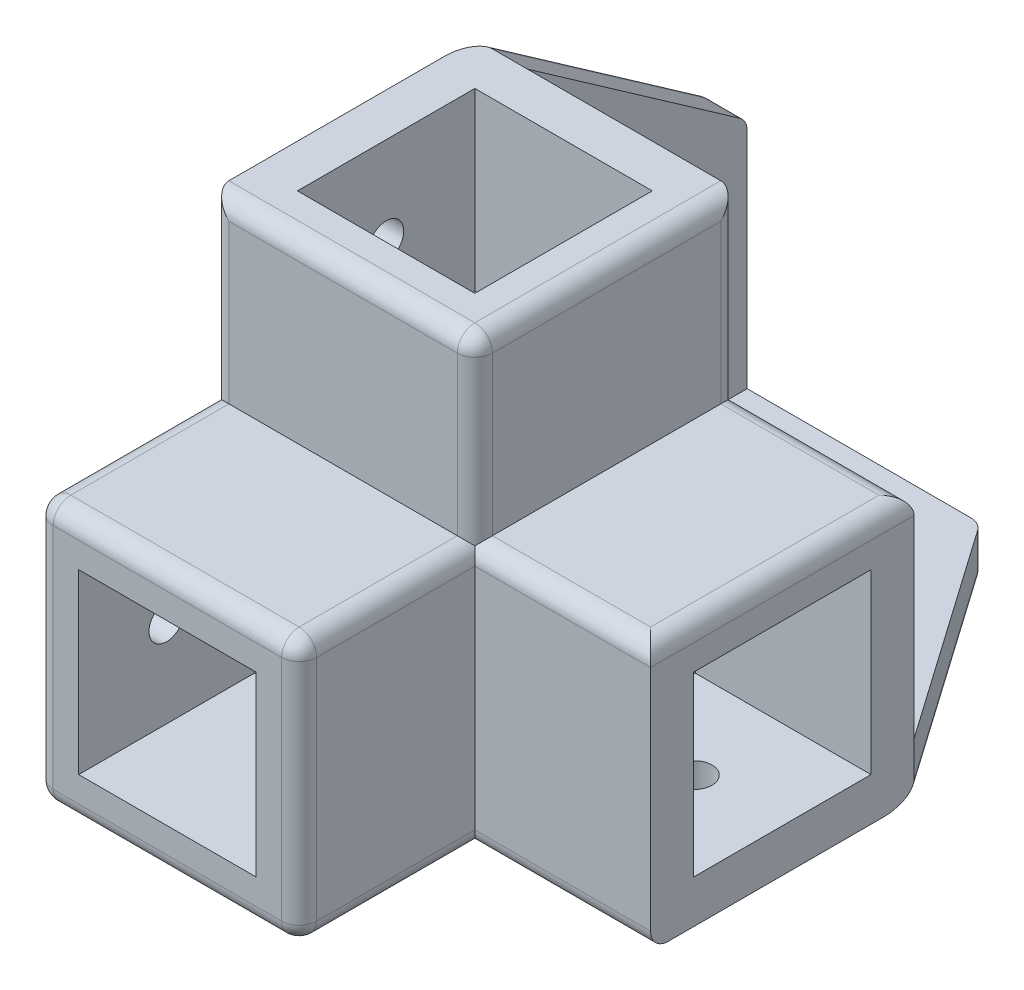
SolidWorks part; units mm, degrees
ref_plane "Alzado" through (0, 0, 0) normal (0, 0, 1) x (1, 0, 0)
ref_plane "Planta" through (0, 0, 0) normal (0, 1, 0) x (1, 0, 0)
ref_plane "Vista lateral" through (0, 0, 0) normal (1, 0, 0) x (0, 0, -1)
sketch "Sketch1" plane through (0, 0, 0) normal (0, 0, 1) x (1, 0, 0)
  line L1 (0, 50) -> (30, 50)
  line L2 (0, 50) -> (0, 0)
  line L3 (0, 0) -> (50, 0)
  line L4 (30, 50) -> (30, 30)
  line L5 (50, 0) -> (0, 0)
  line L6 (50, 0) -> (50, 30)
  line L7 (50, 30) -> (30, 30)
  line L8 (0, 0) -> (0, 50)
  dimension "D1" = 30
  dimension "D2" = 30
  dimension "D3" = 20
  dimension "D4" = 20
extrude "Boss-Extrude1" add sketch "Sketch1" along normal blind 30 contours L2 L1 L4 L7 L6 L5
sketch "Sketch2" plane through (0, 0, 30) normal (0, 0, 1) x (1, 0, 0)
  line L1 (30, 30) -> (0, 30)
  line L2 (30, 30) -> (30, 0)
  line L3 (30, 0) -> (0, 0)
  line L4 (0, 30) -> (0, 0)
extrude "Boss-Extrude2" add sketch "Sketch2" along normal blind 20
sketch "Sketch3" plane through (0, 0, 50) normal (0, 0, 1) x (1, 0, 0)
  line L0 (0, 0) -> (30, 0) construction
  line L1 (4.9, 25.1) -> (25.1, 25.1)
  line L2 (4.9, 25.1) -> (4.9, 4.9)
  line L3 (4.9, 4.9) -> (25.1, 4.9)
  line L4 (25.1, 25.1) -> (25.1, 4.9)
  line L5 (4.9, 25.1) -> (25.1, 4.9) construction
  line L6 (4.9, 4.9) -> (25.1, 25.1) construction
  line L7 (0, 30) -> (0, 0) construction
  point P0 (15, 15)
  point P8 (15, 0)
  point P11 (0, 15)
  dimension "D1" = 20.2
  dimension "D2" = 20.2
extrude "Cut-Extrude1" cut sketch "Sketch3" against normal blind 20
sketch "Sketch4" plane through (50, 0, 0) normal (1, 0, 0) x (0, 0, -1)
  line L0 (0, 0) -> (0, 30) construction
  line L1 (-25.1, 25.1) -> (-4.9, 25.1)
  line L2 (-25.1, 25.1) -> (-25.1, 4.9)
  line L3 (-25.1, 4.9) -> (-4.9, 4.9)
  line L4 (-4.9, 25.1) -> (-4.9, 4.9)
  line L5 (-25.1, 25.1) -> (-4.9, 4.9) construction
  line L6 (-25.1, 4.9) -> (-4.9, 25.1) construction
  line L7 (-30, 0) -> (0, 0) construction
  point P0 (-15, 15)
  point P7 (0, 15)
  point P10 (-15, 0)
extrude "Cut-Extrude2" cut sketch "Sketch4" against normal blind 20
sketch "Sketch5" plane through (0, 50, 0) normal (0, 1, 0) x (1, 0, 0)
  line L0 (0, -30) -> (0, 0) construction
  line L1 (4.9, -4.9) -> (25.1, -4.9)
  line L2 (4.9, -4.9) -> (4.9, -25.1)
  line L3 (4.9, -25.1) -> (25.1, -25.1)
  line L4 (25.1, -4.9) -> (25.1, -25.1)
  line L5 (4.9, -4.9) -> (25.1, -25.1) construction
  line L6 (4.9, -25.1) -> (25.1, -4.9) construction
  line L7 (0, -30) -> (30, -30) construction
  point P0 (15, -15)
  point P7 (0, -15)
  point P10 (15, -30)
extrude "Cut-Extrude3" cut sketch "Sketch5" against normal blind 20
sketch "Sketch6" plane through (0, 0, 0) normal (0, -1, 0) x (1, 0, 0)
  line L0 (0, 0) -> (0, -25)
  line L1 (0, -25) -> (32.4948, -25)
  line L2 (32.4948, -25) -> (50, 0)
  line L3 (50, 0) -> (0, 0)
  line L4 (6, -6) -> (6, -19)
  line L5 (6, -19) -> (29.3714, -19)
  line L6 (29.3714, -19) -> (38.4741, -6)
  line L7 (38.4741, -6) -> (6, -6)
  dimension "D1" = 125
  dimension "D2" = 25
  dimension "D3" = 6
  dimension "D4" = 6
  dimension "D5" = 6
  dimension "D6" = 6
extrude "Boss-Extrude3" add sketch "Sketch6" against normal blind 6
sketch "Sketch8" plane through (0, 0, 0) normal (-1, 0, 0) x (0, 0, 1)
  line L0 (-25, 6) -> (-25, 32.4948)
  line L1 (-25, 32.4948) -> (0, 50)
  line L2 (0, 50) -> (0, 6)
  line L3 (0, 6) -> (-6, 6)
  line L4 (-19, 6) -> (-19, 29.3714)
  line L5 (-19, 29.3714) -> (-6, 38.4741)
  line L6 (-6, 38.4741) -> (-6, 6)
  line L7 (-19, 6) -> (-25, 6)
  dimension "D1" = 125
  dimension "D2" = 6
  dimension "D3" = 6
  dimension "D4" = 6
extrude "Boss-Extrude4" add sketch "Sketch8" against normal blind 6
fillet "Fillet1" radius 2 3 edges at (30, 30, 40) (30, 0, 40) (40, 0, 30)
fillet "Fillet4" radius 2 6 edges at (14, 30, 50) (29.4142, 29.4142, 50) (30, 15, 50) (29.4142, 0.5858, 50) (14, 0, 50) (0, 0, 12.5)
fillet "Fillet6" radius 2 3 edges at (0, 17.2474, -25) (0.5858, 0.5858, -25) (17.2474, 0, -25)
fillet "Fillet10" radius 2 3 edges at (4, 32.4948, -25) (0.5858, 32.905, -24.4142) (0, 41.9476, -11.5)
fillet "Fillet11" radius 2 3 edges at (32.4948, 4, -25) (32.905, 0.5858, -24.4142) (41.9476, 0, -11.5)
fillet "Fillet13" radius 2 12 edges at (0.5858, 0.5858, 49.4142) (0, 15, 50) (0, 29.4142, 49.4142) (30, 40, 0) (40, 30, 0) (30, 50, 15) (0, 30, 39) (0, 40, 30) (15, 50, 30) (30, 40, 30) (50, 30, 15) (40, 30, 30)
sketch "Sketch10" plane through (0, 0, 0) normal (0, -1, 0) x (1, 0, 0)
  line L0 (50, 28) -> (50, 3.4869) construction
  line L1 (30, 30) -> (50, 30) construction
  circle A0 centre (40, 15) radius 2
extrude "Cut-Extrude4" cut sketch "Sketch10" against normal blind 10
sketch "Sketch11" plane through (0, 0, 0) normal (-1, 0, 0) x (0, 0, 1)
  line L0 (28, 50) -> (3.4869, 50) construction
  line L1 (30, 48) -> (30, 30) construction
  circle A0 centre (15, 40) radius 2
extrude "Cut-Extrude5" cut sketch "Sketch11" against normal blind 10
sketch "Sketch12" plane through (0, 0, 0) normal (-1, 0, 0) x (0, 0, 1)
  line L0 (50, 28) -> (50, 2) construction
  line L1 (48, 2) -> (48, 28) construction
  circle A0 centre (40, 15) radius 2
  point P6 (48, 15)
extrude "Cut-Extrude6" cut sketch "Sketch12" against normal blind 10
equation "\"tornillo\"= 4"
equation "\"D1@Sketch10\"=\"tornillo\""
equation "\"D1@Sketch11\"=\"tornillo\""
equation "\"D1@Sketch12\"=\"tornillo\""
equation "\"enmedio\"=15"
equation "\"D3@Sketch11\"=\"enmedio\""
equation "\"D3@Sketch10\"=\"enmedio\""
equation "\"tolerancia\"=20.2"
equation "\"D1@Sketch4\"=\"tolerancia\""
equation "\"D2@Sketch4\"=\"tolerancia\""
equation "\"D1@Sketch5\"=\"tolerancia\""
